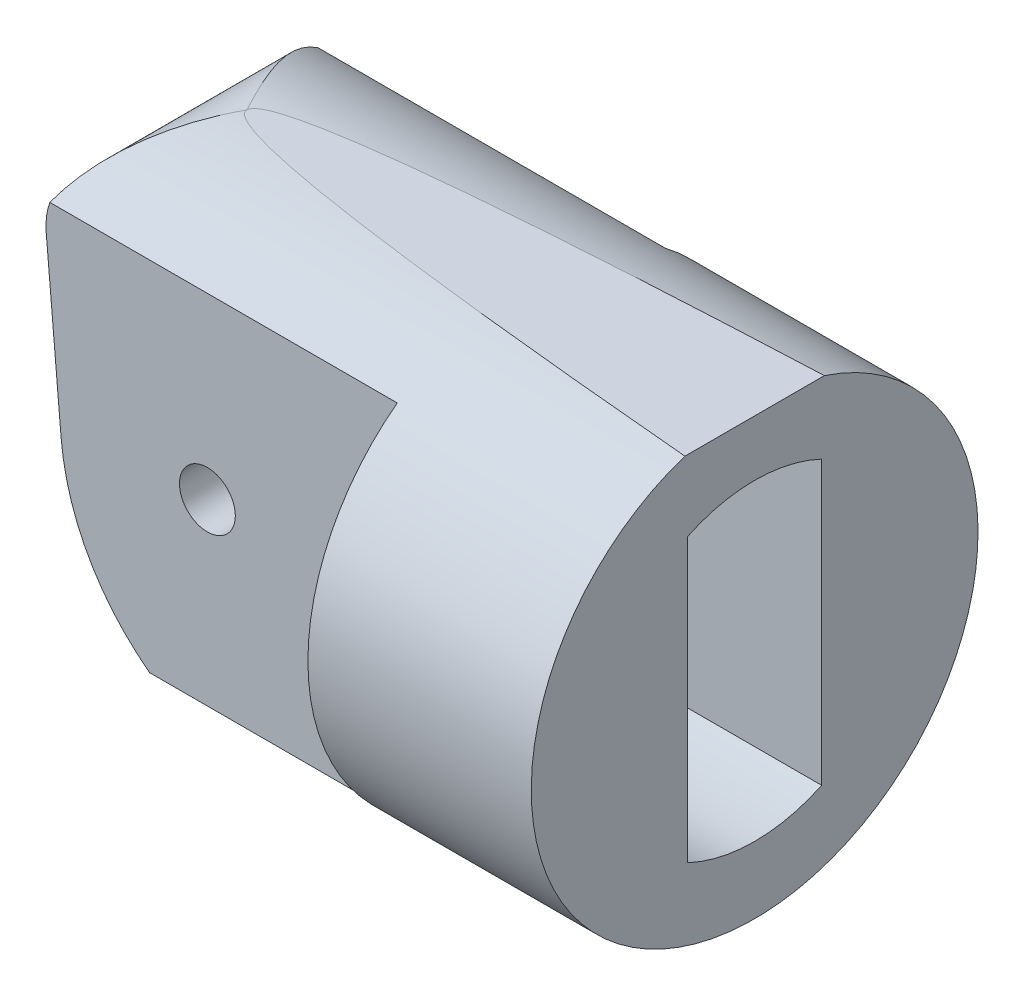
SolidWorks part; units mm, degrees
ref_plane "Plan de face" through (0, 0, 0) normal (0, 0, 1) x (1, 0, 0)
ref_plane "Plan de dessus" through (0, 0, 0) normal (0, 1, 0) x (1, 0, 0)
ref_plane "Plan de droite" through (0, 0, 0) normal (1, 0, 0) x (0, 0, -1)
sketch "Esquisse1" plane through (0, 0, 0) normal (1, 0, 0) x (0, 0, -1)
  circle A0 centre (0, 0) radius 10
  dimension "D1" = 20
extrude "Boss.-Extru.1" add sketch "Esquisse1" against normal blind 26
sketch "Esquisse3" plane through (0, 0, 0) normal (0, 1, 0) x (1, 0, 0)
  line L0 (-26, 0) -> (-26, -6)
  line L2 (0, 0) -> (-26, 0) construction
  line L7 (-26, 10) -> (-26, -10) construction
  line L8 (-26, -10) -> (0, -10) construction
  line L9 (-26, -10) -> (-10, -10)
  line L10 (-26, -10) -> (-26, -6)
  line L11 (-26, 6) -> (-10, 6)
  line L12 (-10, -10) -> (-10, -6)
  line L13 (-10, 10) -> (-10, 6)
  line L14 (-26, -6) -> (-10, -6)
  line L15 (-26, 10) -> (-26, 6)
  line L16 (-26, 10) -> (-10, 10)
  dimension "D4" = 16
  dimension "D5" = 12
extrude "Enlèv. mat.-Extru.1" cut sketch "Esquisse3" against normal through all and the other way through all contours L10 L9 L12 L14 | L15 L11 L13 L16
sketch "Esquisse4" plane through (0, 0, 0) normal (0, 0, 1) x (1, 0, 0)
  line L0 (0, 0) -> (-26, 0) construction
  line L1 (-26, 8) -> (-26, -8) construction
  circle A0 centre (-18.5, 0) radius 1.25
  dimension "D1" = 2.5
  dimension "D2" = 7.5
extrude "Enlèv. mat.-Extru.2" cut sketch "Esquisse4" against normal through all and the other way through all
sketch "Esquisse5" plane through (0, 0, 0) normal (0, 0, 1) x (1, 0, 0)
  line L0 (-25.7147, 6.7385) -> (-25.0489, -0.8716)
  line L1 (-26, -10) -> (0, -10) construction
  line L2 (-15.0869, -10) -> (0, -10)
  line L3 (0, -10) -> (0, 10)
  line L4 (0, 10) -> (-22.7261, 10)
  line L5 (-26, 8) -> (-26, -8) construction
  arc A0 (-15.0869, -10) -> (-25.0489, -0.8716) centre (-15.0869, 0) cw
  arc A1 (-22.7261, 10) -> (-25.7147, 6.7385) centre (-22.7261, 7) ccw
  point P13 (-24.2502, -10)
  point P16 (-26, 10)
  dimension "D2" = 10
  dimension "D3" = 3
  dimension "D1" = 5
extrude "Enlèv. mat.-Extru.3" cut sketch "Esquisse5" against normal through all and the other way through all flip side to cut
sketch "Esquisse6" plane through (0, 0, 0) normal (0, 0, 1) x (1, 0, 0)
  line L0 (-22.7261, 10) -> (0, 9.5)
  line L1 (0, -10) -> (0, 10) construction
  line L2 (0, 9.5) -> (0, 10)
  line L3 (0, 10) -> (-22.7261, 10)
  dimension "D1" = 0.5
extrude "Enlèv. mat.-Extru.4" cut sketch "Esquisse6" against normal through all both and the other way through all
sketch "Esquisse7" plane through (0, 0, 0) normal (1, 0, 0) x (0, 0, -1)
  line L4 (3, -6.3246) -> (3, 6.3246)
  line L5 (-3, -6.3246) -> (-3, 6.3246)
  arc A8 (3, 6.3246) -> (0, 7) centre (0, 0) ccw
  arc A9 (0, 7) -> (-3, 6.3246) centre (0, 0) ccw
  arc A10 (-3, -6.3246) -> (0, -7) centre (0, 0) ccw
  arc A11 (0, -7) -> (3, -6.3246) centre (0, 0) ccw
extrude "Enlèv. mat.-Extru.5" cut sketch "Esquisse7" against normal through all both and the other way through all
